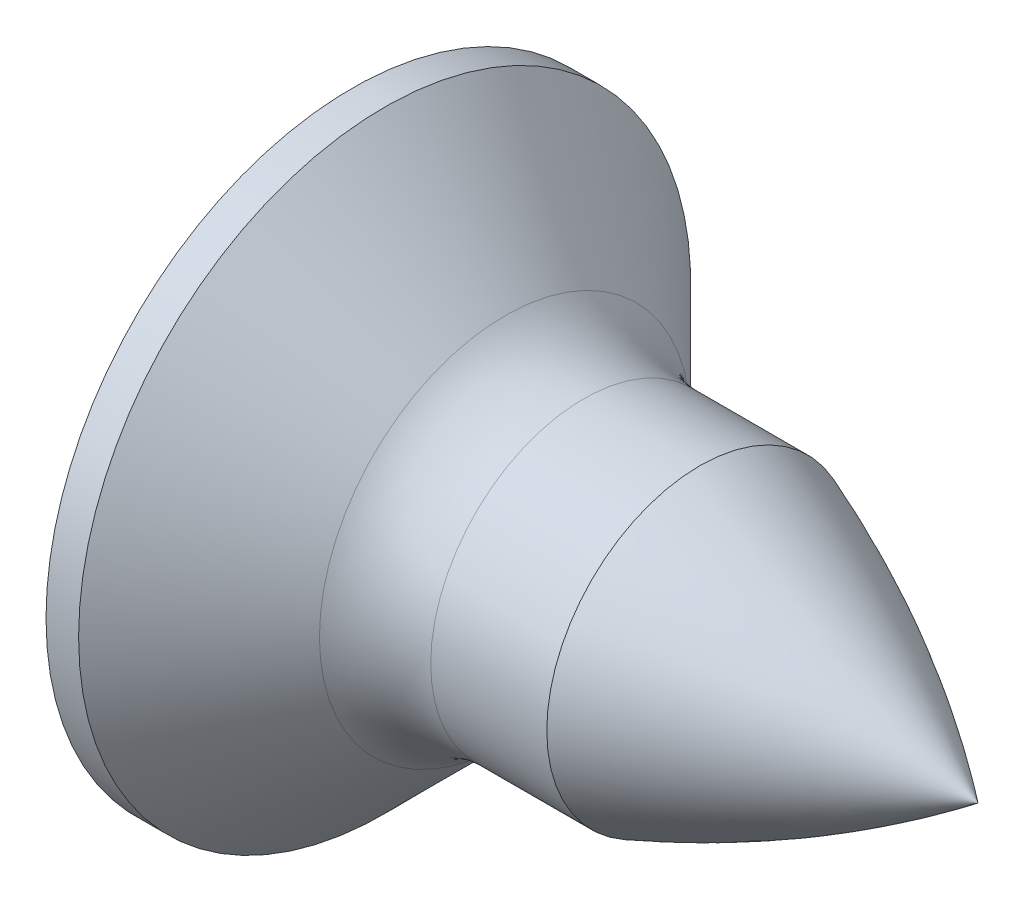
SolidWorks part; units mm, degrees
ref_plane "Front" through (0, 0, 0) normal (0, 0, 1) x (1, 0, 0)
ref_plane "Top" through (0, 0, 0) normal (0, 1, 0) x (1, 0, 0)
ref_plane "Right" through (0, 0, 0) normal (1, 0, 0) x (0, 0, -1)
sketch "Sketch1" plane through (0, 0, 0) normal (0, 0, 1) x (1, 0, 0)
  line L0 (-20.4182, 0) -> (11.3165, 0) construction
  line L1 (5, 0) -> (5, 1.1)
  line L2 (5, 1.1) -> (2.1657, 1.1)
  line L3 (2.4, 2.2) -> (2.4, -0.8442) construction
  line L4 (0.7343, 2.2) -> (0.5, 2.2)
  line L5 (5, 0) -> (0, 0)
  line L6 (1.6, 1.3343) -> (0.7343, 2.2)
  arc A0 (0.5, 2.2) -> (0, 0) centre (5.09, 0) ccw
  arc A1 (2.1657, 1.1) -> (1.6, 1.3343) centre (2.1657, 1.9) cw
  dimension "D2" = 45
  dimension "r" = 0.8
  dimension "st" = 2.2
  dimension "k" = 1.1
  dimension "l" = 4.5
  dimension "dk" = 4.4
  dimension "f" = 0.5
  dimension "a" = 0.8
revolve "Base" add sketch "Sketch1" angle 360 about L0
sketch "Sketch2" plane through (0, 0, 0) normal (1, 0, 0) x (0, 0, -1)
  line L0 (6.5369, 0) -> (-7.0008, 0) construction
  line L1 (0, 6.811) -> (0, -6.4314) construction
  line L2 (-0.22, 1.1) -> (0.22, 1.1)
  line L3 (0.22, 1.1) -> (0.22, 0.22)
  line L4 (0.22, 0.22) -> (1.1, 0.22)
  line L5 (1.1, 0.22) -> (1.1, -0.22)
  line L6 (0.22, -0.22) -> (1.1, -0.22)
  line L7 (0.22, -1.1) -> (0.22, -0.22)
  line L8 (-0.22, -1.1) -> (0.22, -1.1)
  line L9 (-0.22, -1.1) -> (-0.22, -0.22)
  line L10 (-0.22, -0.22) -> (-1.1, -0.22)
  line L11 (-1.1, 0.22) -> (-1.1, -0.22)
  line L12 (-0.22, 0.22) -> (-1.1, 0.22)
  line L13 (-0.22, 1.1) -> (-0.22, 0.22)
  point P5 (-1.1, 0)
  point P11 (1.1, 0)
  point P15 (0, -1.1)
  point P20 (0, 1.1)
  dimension "m" = 2.2
  dimension "D2" = 2.2
  dimension "D3" = 0.44
  dimension "D4" = 0.44
extrude "CrossRecess" cut sketch "Sketch2" along normal blind 1.2
sketch "Sketch3" plane through (0, 0, 0) normal (1, 0, 0) x (0, 0, -1)
  line L0 (-4.5467, 4.5467) -> (4.5467, -4.5467) construction
  line L1 (-0.9538, 0.9538) -> (-0.22, 0.44)
  line L3 (-0.22, 0.44) -> (-0.22, 0.22)
  line L4 (-0.44, 0.22) -> (-0.22, 0.22)
  line L5 (-0.9538, 0.9538) -> (-0.44, 0.22)
  line L6 (7.069, 0) -> (-6.5067, 0) construction
  line L7 (0, 5.9645) -> (0, -0.3816) construction
  line L8 (0.9538, 0.9538) -> (0.44, 0.22)
  line L9 (0.44, 0.22) -> (0.22, 0.22)
  line L10 (0.22, 0.44) -> (0.22, 0.22)
  line L11 (0.9538, 0.9538) -> (0.22, 0.44)
  line L12 (0.9538, -0.9538) -> (0.22, -0.44)
  line L13 (0.22, -0.44) -> (0.22, -0.22)
  line L14 (0.44, -0.22) -> (0.22, -0.22)
  line L15 (0.9538, -0.9538) -> (0.44, -0.22)
  line L16 (-0.9538, -0.9538) -> (-0.44, -0.22)
  line L17 (-0.44, -0.22) -> (-0.22, -0.22)
  line L18 (-0.22, -0.44) -> (-0.22, -0.22)
  line L19 (-0.9538, -0.9538) -> (-0.22, -0.44)
  line L21 (0.22, 0.22) -> (1.1, 0.22) construction
  line L22 (0.22, 1.1) -> (0.22, 0.22) construction
  dimension "D1" = 20
  dimension "D2" = 0.22
extrude "Cut-Extrude2" [suppressed] cut sketch "Sketch3" along normal up to surface (2.25 mm away)
sketch "Sketch4" plane through (0, 0, 0) normal (0, 0, 1) x (1, 0, 0)
  line L0 (35.6282, 0) -> (20.6612, 0) construction
  line L2 (3.4, -1.1) -> (4.2, -1.1)
  line L3 (4.2, -1.1) -> (5, -0.9)
  line L5 (5, -1.1) -> (5, 1.1) construction
  line L6 (3.4, -1.1) -> (3.4, -1.6)
  line L7 (3.4, -1.6) -> (5, -1.6)
  line L8 (5, -1.6) -> (5, -0.9)
  point P15 (4.2, -1.1)
  dimension "D1" = 2.2
  dimension "yf" = 1.6
  dimension "D2" = 0.8
  dimension "D3" = 0.2
  dimension "D4" = 0.5
revolve "Cut-Revolve1" [suppressed] cut sketch "Sketch4" angle 360 about L0
sketch "Sketch5" plane through (0, 0, 0) normal (0, 0, 1) x (1, 0, 0)
  line L0 (37.0407, 0) -> (13.7121, 0) construction
  line L2 (5, -1.1) -> (5, 1.1) construction
  line L3 (5, 0) -> (3, -1.1) construction
  line L6 (5, 0) -> (5.5, 0)
  line L7 (3, -1.1) -> (5, -1.1)
  line L8 (5.5, 0) -> (5.5, -1.1)
  line L9 (5.5, -1.1) -> (5, -1.1)
  arc A0 (5, 0) -> (3, -1.1) centre (0.1841, 6.388) cw
  dimension "D1" = 8
  dimension "D2" = 0.5
  dimension "yc" = 2
  dimension "D3" = 2.2
revolve "Cut-Revolve6" cut sketch "Sketch5" angle 360 about L0
draft "Draft1" type of draft neutral plane draft angle 30 neutral plane "Right" faces to draft 4 parameters "D1"=30
sketch "Sketch6" plane through (0, 0, 0) normal (0, 0, 1) x (1, 0, 0)
  line L0 (2.15, 1.6) -> (2.65, 1.6)
  line L1 (2.65, 1.6) -> (2.65, 1.1)
  line L2 (2.65, 1.1) -> (2.4, 0.667)
  line L3 (2.4, 0.667) -> (2.15, 1.1)
  line L4 (2.15, 1.1) -> (2.15, 1.6)
  line L5 (0, 0) -> (5.4654, 0) construction
  dimension "D1" = 2.2
  dimension "D2" = 0.5
  dimension "D3" = 0.8
revolve "Cut-Revolve10" [suppressed] cut sketch "Sketch6" angle 360 about L5
pattern_linear "LPattern10" [suppressed] count 4 spacing 0.6 along (1, 0, 0)
equation "\"D3@Sketch2\" = \"m@Sketch2\" / 5"
equation "\"D4@Sketch2\" = \"D3@Sketch2\""
equation "\"D2@Sketch2\" = \"m@Sketch2\""
equation "\"D2@Sketch3\" = \"m@Sketch2\" / 10"
equation "\"D3@Sketch4\" = \"yf@Sketch4\" / 8"
equation "\"D2@ThreadCosmetic1\" = \"st@Sketch1\" - 1"
equation "\"D1@Sketch5\" = \"yc@Sketch5\" * 4"
equation "\"D3@Sketch5\" = \"st@Sketch1\""
equation "\"D2@Sketch4\" = \"yf@Sketch4\" / 2"
equation "\"D1@Sketch4\" = \"st@Sketch1\""
equation "\"D1@ThreadCosmetic1\" = \"l@Sketch1\" - \"k@Sketch1\" - \"a@Sketch1\""
equation "\"D1@Sketch6\" = \"st@Sketch1\""
equation "\"D2@Sketch6\" =  ( \"D1@Sketch6\" - \"D2@ThreadCosmetic1\" )  / 2"
equation "\"D3@Sketch6\" = \"a@Sketch1\""
equation "\"D3@LPattern10\" = \"D2@Sketch6\" * 1.2"
equation "\"D1@LPattern10\" = \"D1@ThreadCosmetic1\" / \"D3@LPattern10\""
